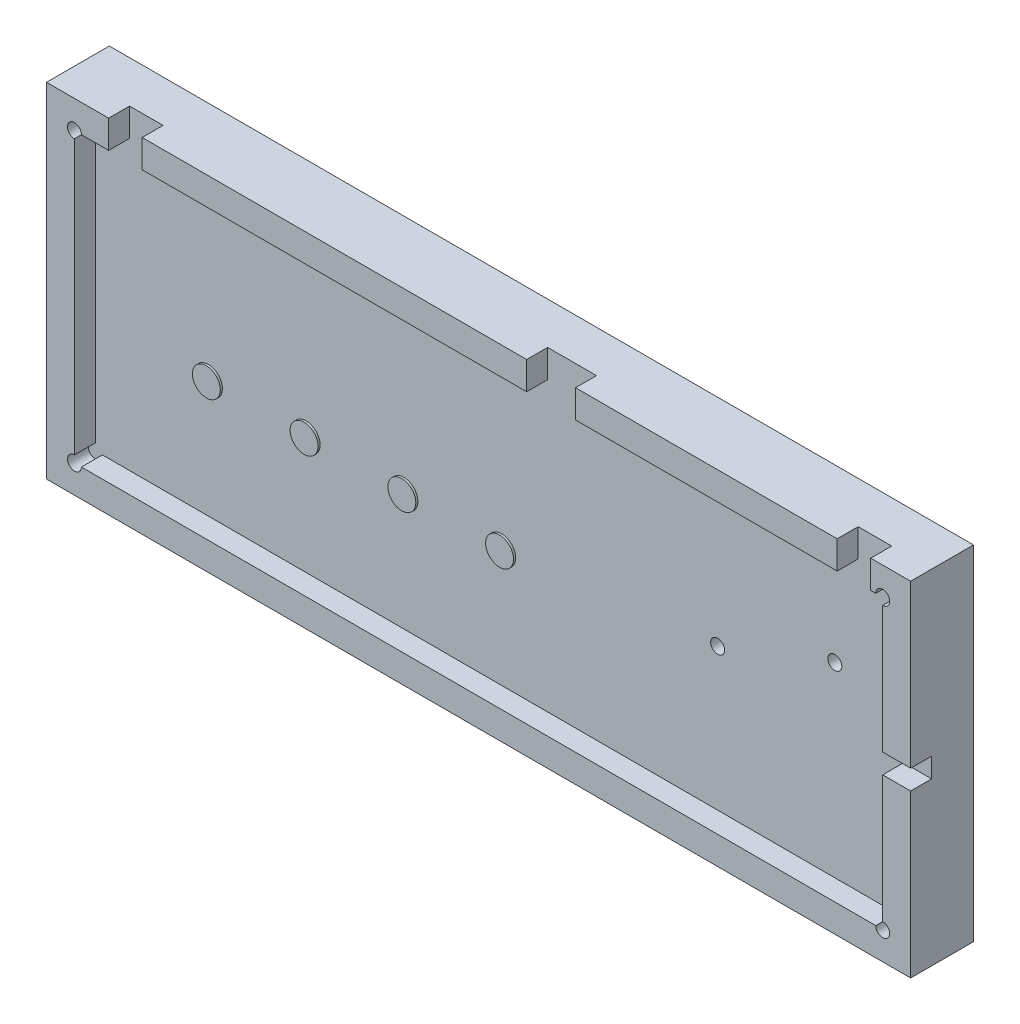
SolidWorks part; units mm, degrees
ref_plane "Front Plane" through (0, 0, 0) normal (0, 0, 1) x (1, 0, 0)
ref_plane "Top Plane" through (0, 0, 0) normal (0, 1, 0) x (1, 0, 0)
ref_plane "Right Plane" through (0, 0, 0) normal (1, 0, 0) x (0, 0, -1)
sketch "Sketch1" plane through (0, 0, 0) normal (0, 0, 1) x (1, 0, 0)
  line L1 (0, 0) -> (135.57, 0)
  line L2 (0, 0) -> (0, 61.02)
  line L3 (0, 61.02) -> (135.57, 61.02)
  line L4 (135.57, 0) -> (135.57, 61.02)
  dimension "D1" = 135.57
  dimension "D2" = 61.02
extrude "Extrude1" add sketch "Sketch1" along normal blind 5
sketch "Sketch3" plane through (0, 0, 5) normal (0, 0, 1) x (1, 0, 0)
  line L0 (135.57, 61.02) -> (0, 61.02) construction
  line L1 (9.9, 51.12) -> (77.09, 51.12)
  line L2 (9.9, 51.12) -> (9.9, 9.9)
  line L3 (9.9, 9.9) -> (77.09, 9.9)
  line L5 (77.09, 51.12) -> (125.67, 51.12)
  line L7 (77.09, 9.9) -> (125.67, 9.9)
  line L8 (125.67, 51.12) -> (125.67, 9.9)
  line L9 (0, 0) -> (135.57, 0) construction
  line L10 (0, 61.02) -> (0, 0) construction
  point P12 (0, 30.51)
  dimension "D1" = 9.9
  dimension "D2" = 9.9
  dimension "D3" = 9.9
  dimension "D4" = 67.19
  dimension "D5" = 48.58
extrude "Cut-Extrude1" cut sketch "Sketch3" against normal blind 3
sketch "Sketch5" plane through (0, 0, 5) normal (0, 0, 1) x (1, 0, 0)
  line L0 (9.9, 9.9) -> (125.67, 9.9) construction
  line L1 (9.9, 51.12) -> (9.9, 9.9) construction
  circle A0 centre (125.67, 51.12) radius 1
  circle A1 centre (9.9, 51.12) radius 1
  circle A2 centre (9.9, 9.9) radius 1
  circle A3 centre (125.67, 9.9) radius 1
extrude "Cut-Extrude2" cut sketch "Sketch5" against normal up to surface (3 mm away)
sketch "Sketch6" plane through (0, 0, 2) normal (0, 0, 1) x (1, 0, 0)
  circle A2 centre (99.0222, 30.2259) radius 1
  circle A3 centre (115.8075, 36.6118) radius 1
extrude "Cut-Extrude3" cut sketch "Sketch6" against normal up to next
sketch "Sketch7" plane through (0, 61.02, 0) normal (0, 1, 0) x (-1, 0, 0)
  line L0 (-14.8, 2) -> (-19.6, 2)
  line L1 (-14.8, 5) -> (-19.6, 5)
  line L12 (-76.99, 7.57) -> (-76.99, 2)
  line L13 (-76.99, 2) -> (-19.6, 2)
  line L14 (-19.6, 2) -> (-19.6, 5)
  line L15 (-19.6, 5) -> (-17.8, 5)
  line L16 (-17.8, 5) -> (-17.8, 2)
  line L17 (-17.8, 2) -> (-16.6, 2)
  line L18 (-16.6, 2) -> (-16.6, 5)
  line L19 (-16.6, 5) -> (-14.8, 5)
  line L20 (-14.8, 5) -> (-14.8, 2)
  line L21 (-14.8, 2) -> (-10, 2)
  line L22 (-10, 2) -> (-10, 7.57)
  line L23 (-10, 7.57) -> (-76.99, 7.57)
  line L26 (-19.6, 2) -> (-19.6, 5)
  line L32 (-14.8, 5) -> (-14.8, 2)
  dimension "D1" = 0
extrude "Cut-Extrude4" cut sketch "Sketch7" against normal up to next
sketch "Sketch8" plane through (0, 61.02, 0) normal (0, 1, 0) x (-1, 0, 0)
  line L0 (-119.15, 2) -> (-123.95, 2)
  line L1 (-119.15, 5) -> (-123.95, 5)
  line L31 (-123.95, 2) -> (-123.95, 5)
  line L473 (-119.15, 5) -> (-119.15, 2)
extrude "Cut-Extrude5" cut sketch "Sketch8" against normal up to next
sketch "Sketch9" plane through (135.57, 0, 0) normal (1, 0, 0) x (0, 0, -1)
  line L0 (-5, 0) -> (-5, 61.02) construction
  line L1 (-5, 29.0977) -> (-2, 29.0977)
  line L2 (-5, 29.0977) -> (-5, 31.9223)
  line L3 (-5, 31.9223) -> (-2, 31.9223)
  line L4 (-2, 29.0977) -> (-2, 31.9223)
  dimension "D2" = 3
extrude "Cut-Extrude6" cut sketch "Sketch9" against normal up to next
sketch "Sketch10" plane through (0, 0, 5) normal (0, 0, 1) x (1, 0, 0)
  line L0 (119.15, 51.12) -> (19.6, 51.12) construction
  line L1 (5.9, 55.12) -> (129.67, 55.12)
  line L2 (5.9, 55.12) -> (5.9, 5.9)
  line L3 (5.9, 5.9) -> (129.67, 5.9)
  line L4 (129.67, 55.12) -> (129.67, 5.9)
  line L5 (125.67, 31.9223) -> (125.67, 50.12) construction
  line L6 (10.9, 9.9) -> (124.67, 9.9) construction
  line L7 (9.9, 50.12) -> (9.9, 10.9) construction
  line L9 (0, 61.02) -> (135.57, 61.02)
  line L10 (0, 61.02) -> (0, 0)
  line L11 (0, 0) -> (135.57, 0)
  line L12 (135.57, 61.02) -> (135.57, 0)
  dimension "D1" = 4
  dimension "D2" = 4
  dimension "D3" = 4
  dimension "D4" = 4
extrude "Cut-Extrude7" cut sketch "Sketch10" against normal through all
sketch "Sketch11" plane through (0, 0, 0) normal (0, 0, -1) x (-1, 0, 0)
  line L1 (-129.67, 55.12) -> (-5.9, 55.12)
  line L2 (-129.67, 55.12) -> (-129.67, 5.9)
  line L3 (-129.67, 5.9) -> (-5.9, 5.9)
  line L4 (-5.9, 55.12) -> (-5.9, 5.9)
  circle A0 centre (-99.0222, 30.2259) radius 1.075
  circle A1 centre (-115.8075, 36.6118) radius 0.988
extrude "Extrude2" add sketch "Sketch11" along normal blind 4
sketch "Sketch13" plane through (0, 0, 2) normal (0, 0, 1) x (1, 0, 0)
  circle A0 centre (26.09, 26.71) radius 2
extrude "Extrude4" add sketch "Sketch13" along normal blind 0.3
pattern_linear "LPattern2" count 4 spacing 14 along (1, 0, 0) of "Extrude4"
sketch "Sketch14" plane through (0, 0, 5) normal (0, 0, 1) x (1, 0, 0)
  line L1 (119.15, 55.12) -> (19.6, 55.12) construction
  line L2 (74.67, 55.12) -> (81.67, 55.12)
  line L3 (74.67, 55.12) -> (74.67, 51.12)
  line L4 (74.67, 51.12) -> (81.67, 51.12)
  line L5 (81.67, 55.12) -> (81.67, 51.12)
  line L6 (119.15, 51.12) -> (19.6, 51.12) construction
  line L7 (125.67, 31.9223) -> (125.67, 50.12) construction
  dimension "D1" = 44
  dimension "D2" = 51
extrude "Cut-Extrude8" cut sketch "Sketch14" against normal up to surface (3 mm away)
